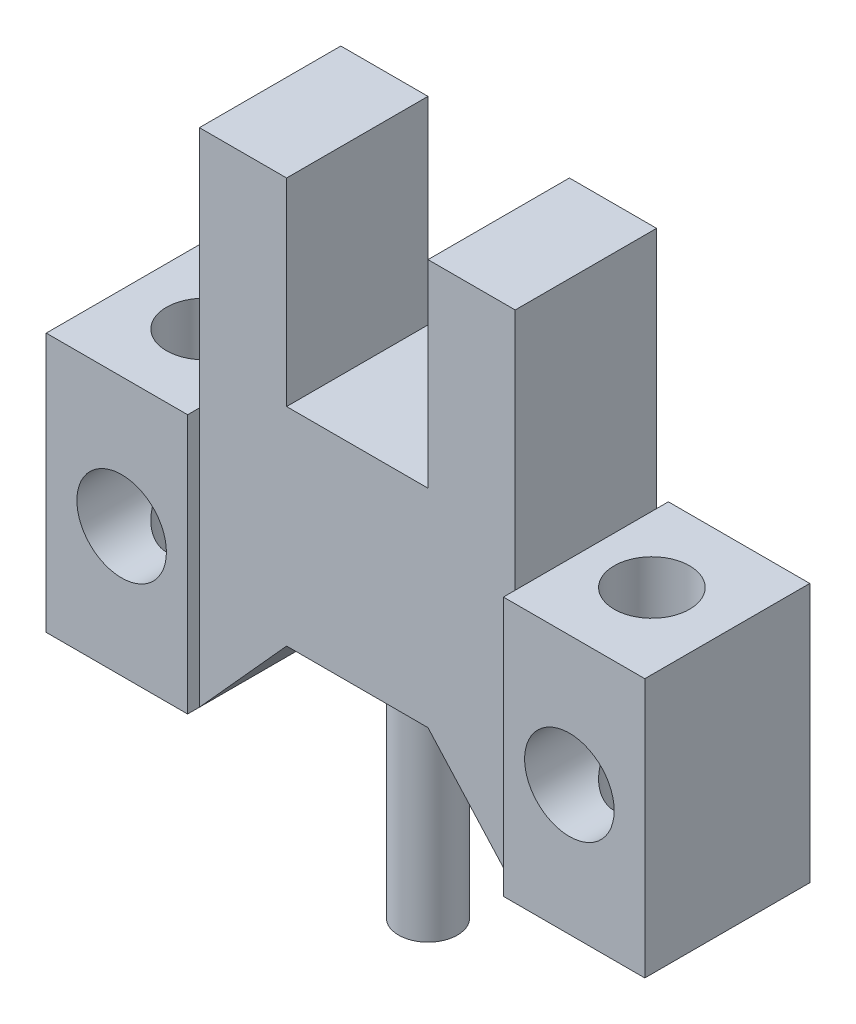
SolidWorks part; units mm, degrees
ref_plane "前视基准面" through (0, 0, 0) normal (0, 0, 1) x (1, 0, 0)
ref_plane "上视基准面" through (0, 0, 0) normal (0, 1, 0) x (1, 0, 0)
ref_plane "右视基准面" through (0, 0, 0) normal (1, 0, 0) x (0, 0, -1)
sketch "草图1" plane through (0, 0, 0) normal (0, 0, 1) x (1, 0, 0)
  line L0 (0, 0) -> (0, 11)
  line L1 (0, 11) -> (6, 11)
  line L2 (6, 11) -> (6, 21.3)
  line L3 (6, 21.3) -> (9.7, 21.3)
  line L4 (9.7, 21.3) -> (9.7, 11)
  line L5 (9.7, 11) -> (15.7, 11)
  line L6 (15.7, 11) -> (15.7, 21.3)
  line L7 (15.7, 21.3) -> (19.4, 21.3)
  line L8 (19.4, 21.3) -> (19.4, 11)
  line L9 (19.4, 11) -> (25.4, 11)
  line L10 (25.4, 11) -> (25.4, 0)
  line L11 (0, 0) -> (6, 0)
  line L13 (9.7, 4.1) -> (15.7, 4.1)
  line L14 (25.4, 0) -> (19.4, 0)
  line L15 (19.4, 0) -> (15.7, 4.1)
  line L16 (6, 0) -> (9.7, 4.1)
extrude "凸台-拉伸5" add sketch "草图1" along normal blind 7 contours L2 L3 L4 L5 L6 L7 L8 L9 L10 L14 L15 L13 L16 L11 L0 L1
sketch "草图9" plane through (0, 0, 7) normal (0, 0, 1) x (1, 0, 0)
  line L0 (6, 0) -> (6, 21.3)
  line L1 (6, 21.3) -> (9.7, 21.3)
  line L2 (9.7, 21.3) -> (9.7, 11)
  line L3 (9.7, 11) -> (15.7, 11)
  line L4 (15.7, 11) -> (15.7, 21.3)
  line L5 (15.7, 21.3) -> (19.4, 21.3)
  line L6 (19.4, 21.3) -> (19.4, 0)
  line L7 (19.4, 0) -> (15.7, 4.1)
  line L8 (15.7, 4.1) -> (9.7, 4.1)
  line L9 (9.7, 4.1) -> (6, 0)
extrude "切除-拉伸7" cut sketch "草图9" against normal blind 0.5
sketch "草图10" plane through (0, 0, 0) normal (0, 0, -1) x (-1, 0, 0)
  line L0 (-19.4, 0) -> (-19.4, 21.3)
  line L1 (-19.4, 21.3) -> (-15.7, 21.3)
  line L2 (-15.7, 21.3) -> (-15.7, 11)
  line L3 (-15.7, 11) -> (-9.7, 11)
  line L4 (-9.7, 11) -> (-9.7, 21.3)
  line L5 (-9.7, 21.3) -> (-6, 21.3)
  line L6 (-6, 21.3) -> (-6, 0)
  line L7 (-6, 0) -> (-9.7, 4.1)
  line L8 (-9.7, 4.1) -> (-15.7, 4.1)
  line L9 (-15.7, 4.1) -> (-19.4, 0)
extrude "切除-拉伸8" cut sketch "草图10" against normal blind 0.5
sketch "草图11" plane through (0, 0, 7) normal (0, 0, 1) x (1, 0, 0)
  circle A0 centre (3.2, 5.5) radius 1.9
extrude "切除-拉伸11" cut sketch "草图11" against normal blind 7 contours A0
sketch "草图15" plane through (0, 0, 7) normal (0, 0, 1) x (1, 0, 0)
  circle A0 centre (22.2, 5.5) radius 1.9
extrude "切除-拉伸12" cut sketch "草图15" against normal blind 7
sketch "草图16" plane through (0, 11, 0) normal (0, 1, 0) x (1, 0, 0)
  circle A0 centre (3.2, -3.5) radius 1.6
extrude "切除-拉伸13" cut sketch "草图16" against normal blind 11
sketch "草图17" plane through (0, 11, 0) normal (0, 1, 0) x (1, 0, 0)
  circle A0 centre (22.2, -3.5) radius 1.6
extrude "切除-拉伸14" cut sketch "草图17" against normal blind 11
sketch "草图18" plane through (0, 4.1, 0) normal (0, -1, 0) x (1, 0, 0)
  circle A0 centre (12.7, 3.5) radius 1.25
extrude "凸台-拉伸7" add sketch "草图18" along normal blind 10
sketch "草图19" plane through (0, 11, 0) normal (0, 1, 0) x (1, 0, 0)
  line L0 (9.7, -6.5) -> (9.7, -0.5)
  line L1 (9.7, -0.5) -> (15.7, -0.5)
  line L2 (15.7, -0.5) -> (15.7, -6.5)
  line L3 (15.7, -6.5) -> (9.7, -6.5)
extrude "凸台-拉伸8" add sketch "草图19" along normal blind 1.9
